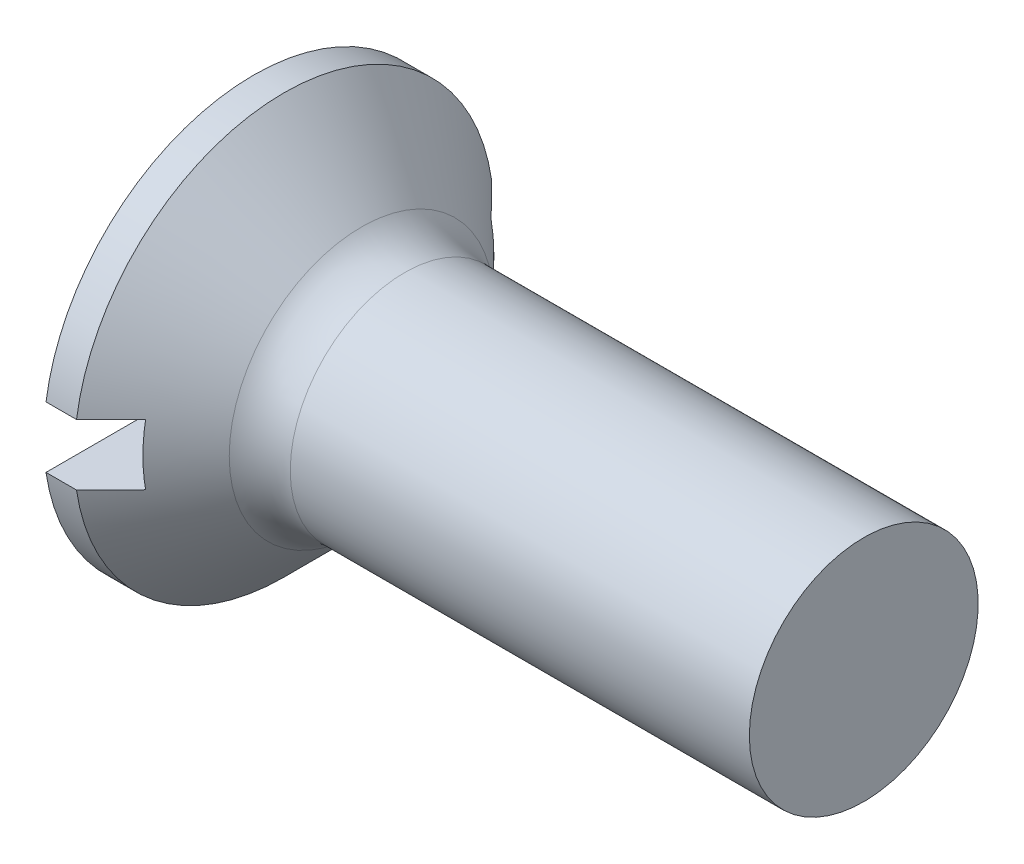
SolidWorks part; units mm, degrees
ref_plane "Plane1" through (0, 0, 0) normal (0, 0, 1) x (1, 0, 0)
ref_plane "Plane2" through (0, 0, 0) normal (0, 1, 0) x (1, 0, 0)
ref_plane "Plane3" through (0, 0, 0) normal (1, 0, 0) x (0, 0, -1)
sketch "BodySke" plane through (0, 0, 0) normal (0, 0, 1) x (1, 0, 0)
  line L0 (0, 0) -> (0, 2.75)
  line L1 (0, 2.75) -> (0.4, 2.75)
  line L2 (1.65, 1.5) -> (8, 1.5)
  line L3 (8, 1.5) -> (8, 0)
  line L4 (8, 0) -> (0, 0)
  line L5 (-6.35, 0) -> (82.55, 0) construction
  line L6 (1.65, -1.5) -> (8, -1.5) construction
  line L7 (0.4, -2.75) -> (1.65, -1.5) construction
  line L8 (0.4, 2.75) -> (1.65, 1.5)
  line L9 (0, -2.75) -> (0.4, -2.75) construction
  line L10 (2.15, 3.0875) -> (2.15, -6.4375) construction
  line L11 (-2, 6.35) -> (-2, -3.175) construction
  dimension "Diameter" = 3
  dimension "Length" = 8
  dimension "Head_ht" = 1.65
  dimension "Head_dia" = 5.5
  dimension "Head_ang" = 90
  dimension "D6" = 0.4
  dimension "Advance" = 0.5
  dimension "Thread_nom" = 10
revolve "Base-Revolve" add sketch "BodySke" angle 360 about L5
fillet "Fillet1" radius 0.8 1 edges at (1.65, 0, 1.5)
sketch "Sketch2" plane through (0, 0, 0) normal (-1, 0, 0) x (0, 0, 1)
  line L0 (-2.75, -0.4) -> (2.75, -0.4)
  line L1 (-2.75, -0.4) -> (-2.75, 0.4)
  line L2 (2.75, 0.4) -> (-2.75, 0.4)
  line L3 (2.75, 0.4) -> (2.75, -0.4)
  dimension "D1" = 0.4
  dimension "Slot_width" = 0.8
  dimension "D2" = 5.5
  dimension "D3" = 2.75
extrude "Slot" cut sketch "Sketch2" against normal blind 0.85
sketch "ThdSchSke" plane through (0, 0, 0) normal (0, 0, 1) x (1, 0, 0)
  line L0 (2.15, -1.2195) -> (1.9536, -1.5)
  line L1 (2.15, -1.2195) -> (2.3464, -1.5)
  line L2 (2.3464, -1.5) -> (2.3464, -1.875)
  line L3 (-3.175, 0) -> (5.1513, 0) construction
  line L5 (2.3464, -1.875) -> (1.9536, -1.875)
  line L6 (1.9536, -1.875) -> (1.9536, -1.5)
  line L7 (0, 2.75) -> (0, 0.4) construction
  dimension "Thread_minor" = 2.439
  dimension "Diameter" = 3
  dimension "Start" = 2.15
  dimension "SideAngle" = 55
  dimension "VeeAngle" = 70
  dimension "Overcut" = 3.75
revolve "ThreadSchematic" [suppressed] cut sketch "ThdSchSke" angle 360 about L3
pattern_linear "ThdSchPat" [suppressed]
equation "\"D1@Sketch2\" = \"Slot_width@Sketch2\" / 2"
equation "\"D2@Sketch2\" = \"Head_dia@BodySke\""
equation "\"D3@Sketch2\" = \"D2@Sketch2\" / 2"
equation "\"Thread_length@ThreadCosmetic\" = ((sgn( (\"Length@BodySke\" - \"Advance@BodySke\" * 1.0 - \"Head_ht@BodySke\" ) - \"Thread_nom@BodySke\" )-1)*( (\"Length@BodySke\" - \"Advance@BodySke\" * 1.0 - \"Head_ht@BodySke\" "
equation "\"Thread_minor@ThdSchSke\" = \"Thread_minor@ThreadCosmetic\""
equation "\"Diameter@ThdSchSke\" = \"Diameter@BodySke\""
equation "\"Overcut@ThdSchSke\" = \"Diameter@BodySke\" * 1.25"
equation "\"Start@ThdSchSke\" = 0.000001 + \"Length@BodySke\" - \"Thread_length@ThreadCosmetic\"  '---Countersunk---"
equation "\"Num_threads@ThdSchPat\" = int( \"Thread_length@ThreadCosmetic\" / \"Advance@BodySke\" + 0.999 )  + 1"
equation "\"Advance@ThdSchPat\" = \"Thread_length@ThreadCosmetic\" /  (\"Num_threads@ThdSchPat\" - 1) 'relax it"
